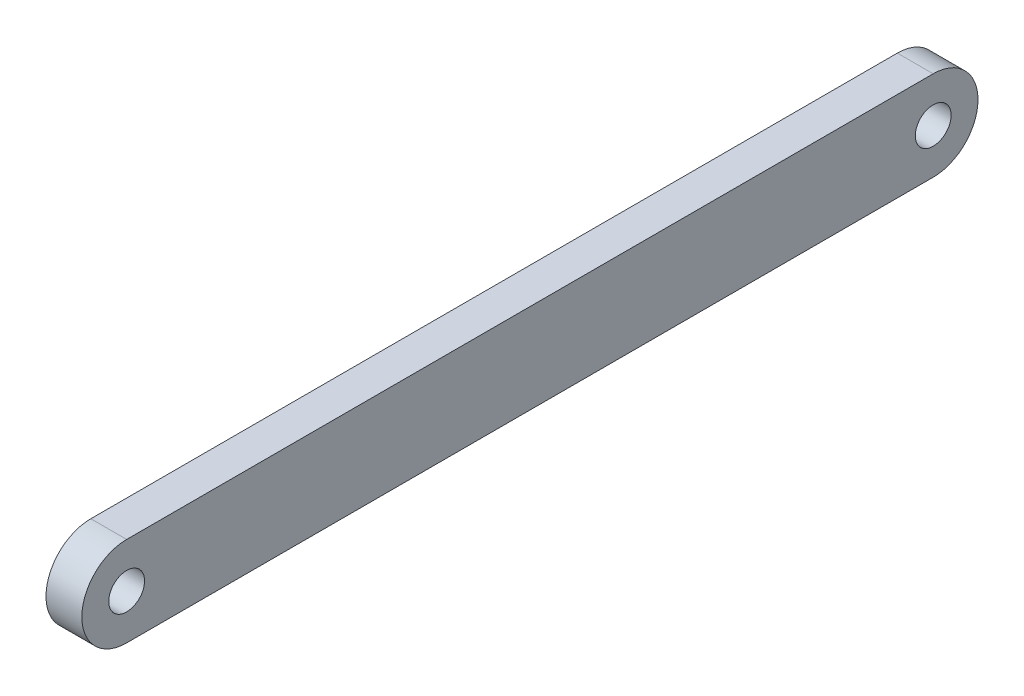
SolidWorks part; units mm, degrees
ref_plane "Piano frontale" through (0, 0, 0) normal (0, 0, 1) x (1, 0, 0)
ref_plane "Piano superiore" through (0, 0, 0) normal (0, 1, 0) x (1, 0, 0)
ref_plane "Piano destro" through (0, 0, 0) normal (1, 0, 0) x (0, 0, -1)
sketch "Sketch1" plane through (0, 0, 0) normal (1, 0, 0) x (0, 0, -1)
  line L0 (0, 0) -> (810, 0) construction
  line L1 (0, 45) -> (810, 45)
  line L2 (0, -45) -> (810, -45)
  line L3 (810, 0) -> (810, 270) construction
  arc A0 (0, 45) -> (0, -45) centre (0, 0) ccw
  arc A1 (810, 45) -> (810, -45) centre (810, 0) cw
  circle A3 centre (0, 0) radius 18
  circle A4 centre (810, 0) radius 18
extrude "Boss-Extrude1" add sketch "Sketch1" against normal blind 36
ref_plane "Plane1" through (-46, 0, 0) normal (-1, 0, 0) x (0, 0, 1)
sketch "Sketch2" plane through (-46, 0, 0) normal (-1, 0, 0) x (0, 0, 1)
  line L0 (0, 0) -> (-810, 0) construction
  circle A0 centre (0, 0) radius 43
  circle A1 centre (-810, 0) radius 43
  circle A3 centre (-810, 0) radius 40.95
  circle A5 centre (0, 0) radius 40.95
extrude "Cut-Extrude1" [suppressed] cut sketch "Sketch2" against normal blind 44
